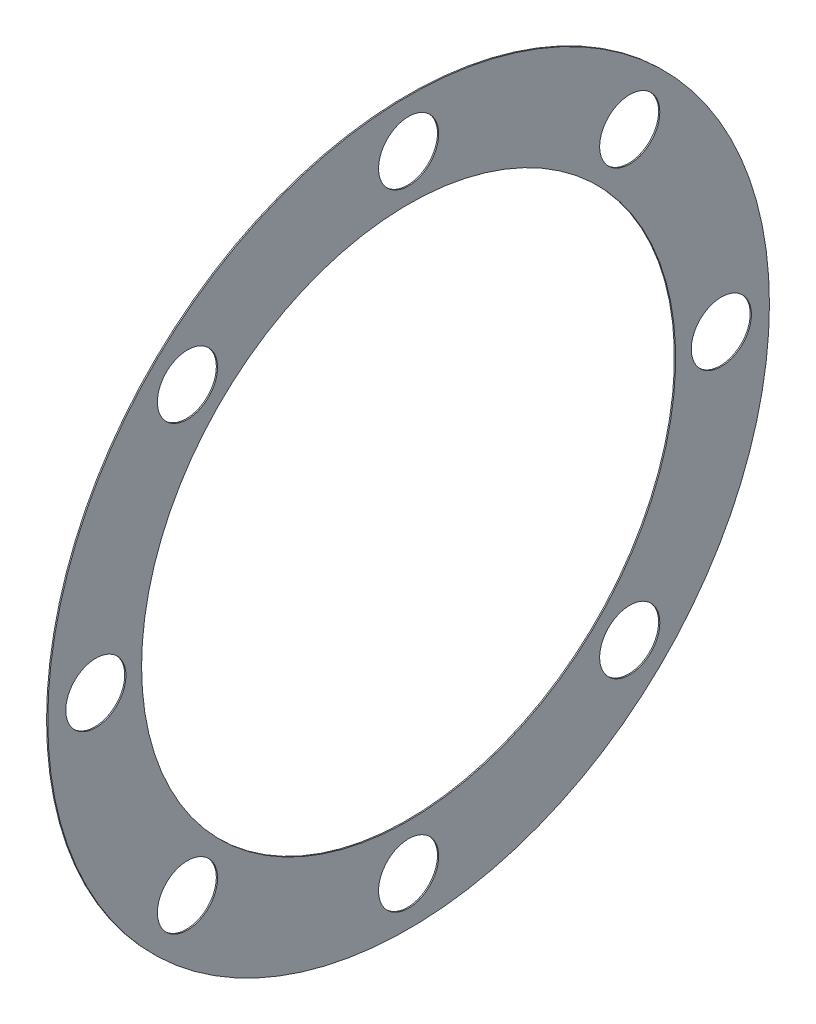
SolidWorks part; units mm, degrees
ref_plane "Face" through (0, 0, 0) normal (0, 0, 1) x (1, 0, 0)
ref_plane "Dessus" through (0, 0, 0) normal (0, 1, 0) x (1, 0, 0)
ref_plane "Droite" through (0, 0, 0) normal (1, 0, 0) x (0, 0, -1)
sketch "Esquisse1" plane through (0, 0, 0) normal (0, 0, 1) x (1, 0, 0)
  line L0 (0, 0) -> (81.871, 0) construction
  line L1 (0, 75) -> (0.25, 75)
  line L2 (0, 75) -> (0, 55.5)
  line L3 (0, 55.5) -> (0.25, 55.5)
  line L4 (0.25, 75) -> (0.25, 55.5)
  dimension "D1" = 75
  dimension "D2" = 55.5
  dimension "D3" = 0.25
revolve "Révolution1" add sketch "Esquisse1" angle 360 about L0
sketch "Esquisse2" plane through (0.25, 0, 0) normal (1, 0, 0) x (0, 0, -1)
  line L0 (0, 0) -> (0, 82.0132) construction
  circle A0 centre (0, 65) radius 6.25
  circle A1 centre (45.9619, 45.9619) radius 6.25
  circle A2 centre (65, 0) radius 6.25
  circle A3 centre (45.9619, -45.9619) radius 6.25
  circle A4 centre (0, -65) radius 6.25
  circle A5 centre (-45.9619, -45.9619) radius 6.25
  circle A6 centre (-65, 0) radius 6.25
  circle A7 centre (-45.9619, 45.9619) radius 6.25
  dimension "D1" = 12.5
  dimension "D2" = 65
extrude "Enlèv. mat.-Extru.1" cut sketch "Esquisse2" against normal through all
